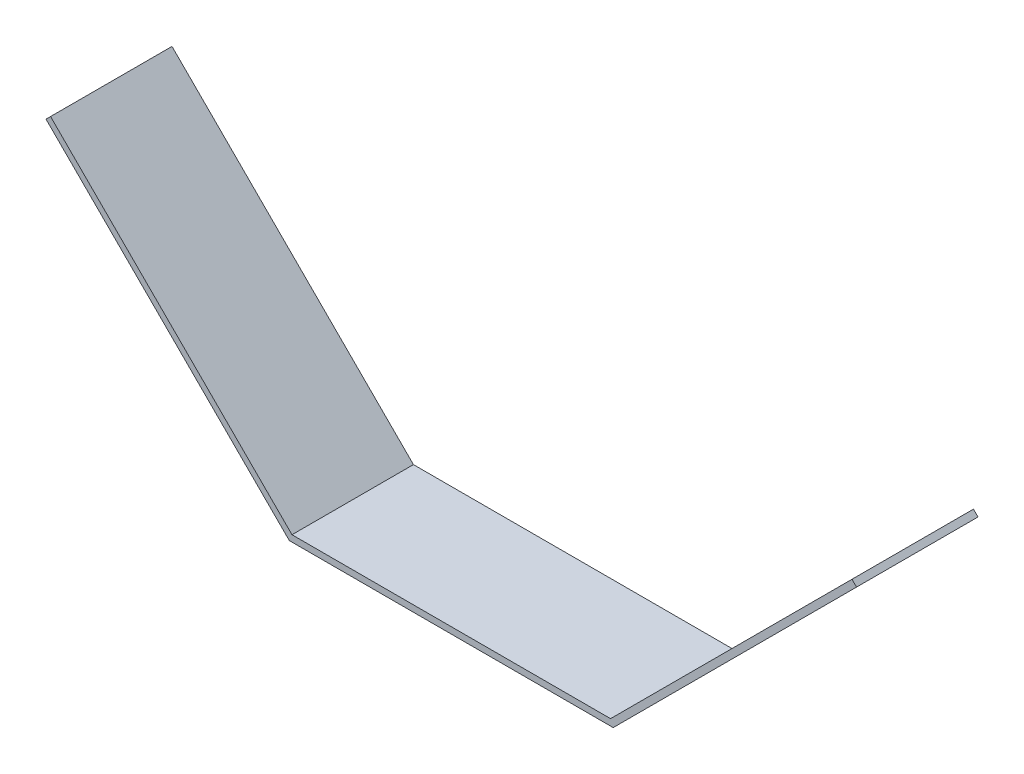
SolidWorks part; units mm, degrees
ref_plane "Front Plane" through (0, 0, 0) normal (0, 0, 1) x (1, 0, 0)
ref_plane "Top Plane" through (0, 0, 0) normal (0, 1, 0) x (1, 0, 0)
ref_plane "Right Plane" through (0, 0, 0) normal (1, 0, 0) x (0, 0, -1)
sketch "Sketch1" plane through (0, 0, 0) normal (0, 0, 1) x (1, 0, 0)
  line L0 (-80, 0) -> (80, 0)
  line L1 (80, 0) -> (200.2082, 120.2082)
  line L2 (200.2082, 120.2082) -> (197.9631, 122.4532)
  line L3 (197.9631, 122.4532) -> (78.6849, 3.175)
  line L4 (78.6849, 3.175) -> (-78.6849, 3.175)
  line L5 (0, 0) -> (0, 131.7507) construction
  line L9 (-197.9631, 122.4532) -> (-78.6849, 3.175)
  line L10 (-200.2082, 120.2082) -> (-197.9631, 122.4532)
  line L11 (-80, 0) -> (-200.2082, 120.2082)
  point P7 (0, 3.175)
  point P9 (0, 3.175)
  dimension "D1" = 80
  dimension "D2" = 170
  dimension "D3" = 45
  dimension "D4" = 3.175
  dimension "D5" = 3.175
extrude "Boss-Extrude1" add sketch "Sketch1" along normal blind 60
